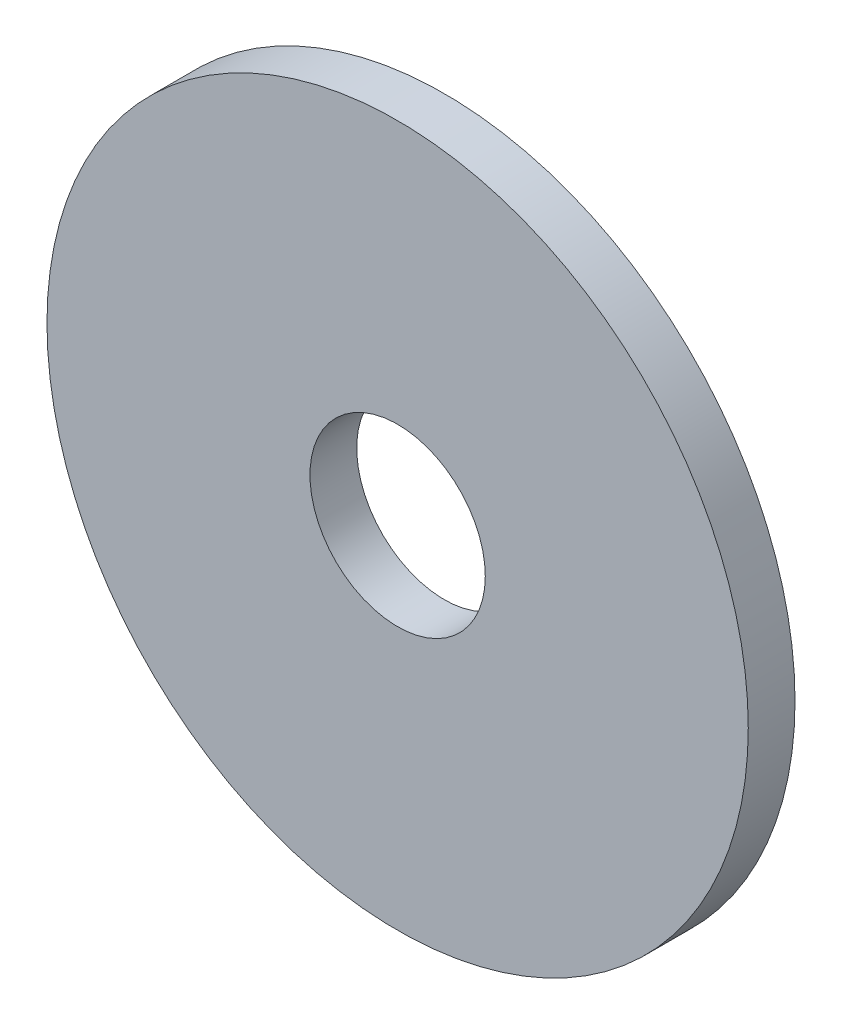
SolidWorks part; units mm, degrees
ref_plane "Front Plane" through (0, 0, 0) normal (0, 0, 1) x (1, 0, 0)
ref_plane "Top Plane" through (0, 0, 0) normal (0, 1, 0) x (1, 0, 0)
ref_plane "Right Plane" through (0, 0, 0) normal (1, 0, 0) x (0, 0, -1)
sketch "Sketch2" plane through (0, 0, 0) normal (0, 0, 1) x (1, 0, 0)
  circle A0 centre (0, 0) radius 1.875
  circle A1 centre (0, 0) radius 7.5
  dimension "D1" = 15
  dimension "D2" = 3.75
extrude "Boss-Extrude1" add sketch "Sketch2" along normal blind 1
